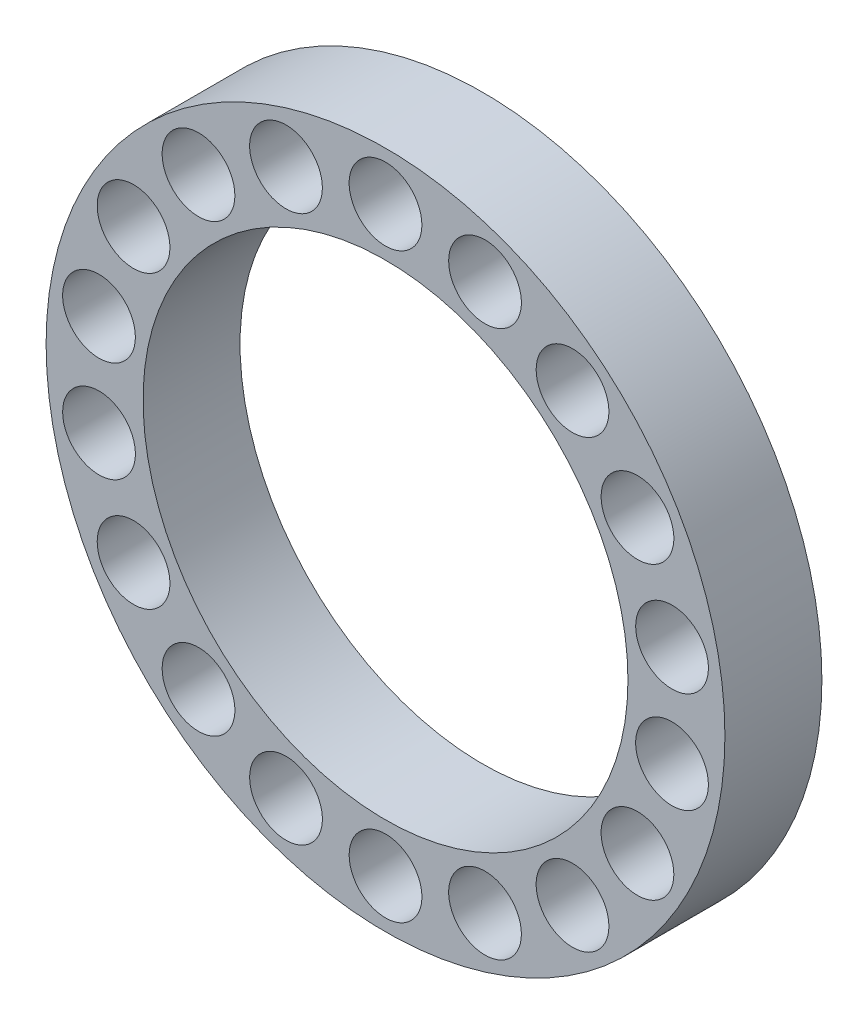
SolidWorks part; units mm, degrees
ref_plane "Front Plane" through (0, 0, 0) normal (0, 0, 1) x (1, 0, 0)
ref_plane "Top Plane" through (0, 0, 0) normal (0, 1, 0) x (1, 0, 0)
ref_plane "Right Plane" through (0, 0, 0) normal (1, 0, 0) x (0, 0, -1)
sketch "Sketch1" plane through (0, 0, 0) normal (0, 0, 1) x (1, 0, 0)
  circle A0 centre (0, 0) radius 6.35
  circle A1 centre (0, 0) radius 8.89
extrude "Boss-Extrude1" add sketch "Sketch1" along normal blind 2.54
sketch "Sketch2" plane through (0, 0, 0) normal (0, 0, 1) x (1, 0, 0)
  circle A0 centre (-4.898, 5.8373) radius 0.9525
  circle A1 centre (-6.5991, 3.81) radius 0.9525
  circle A2 centre (-7.5042, 1.3232) radius 0.9525
  circle A4 centre (0, 7.62) radius 0.9525
  circle A5 centre (-2.6062, 7.1605) radius 0.9525
  circle A6 centre (-2.6062, -7.1605) radius 0.9525
  circle A7 centre (0, -7.62) radius 0.9525
  circle A8 centre (-7.5042, -1.3232) radius 0.9525
  circle A9 centre (-6.5991, -3.81) radius 0.9525
  circle A10 centre (-4.898, -5.8373) radius 0.9525
  circle A11 centre (4.898, -5.8373) radius 0.9525
  circle A12 centre (6.5991, -3.81) radius 0.9525
  circle A13 centre (7.5042, -1.3232) radius 0.9525
  circle A14 centre (2.6062, -7.1605) radius 0.9525
  circle A15 centre (2.6062, 7.1605) radius 0.9525
  circle A16 centre (7.5042, 1.3232) radius 0.9525
  circle A17 centre (6.5991, 3.81) radius 0.9525
  circle A18 centre (4.898, 5.8373) radius 0.9525
extrude "Cut-Extrude2" cut sketch "Sketch2" along normal blind 2.54
sketch "Sketch4" [suppressed] plane through (0, 0, 2.54) normal (0, 0, 1) x (1, 0, 0)
  line L0 (0, 0) -> (-8.6873, 23.8682) construction
  line L1 (0, 0) -> (-16.3268, 19.4575) construction
  line L2 (0, 0) -> (-21.997, 12.7) construction
  line L3 (0, 0) -> (-25.0141, 4.4107) construction
  line L4 (0, 0) -> (-25.0141, -4.4107) construction
  line L5 (0, 0) -> (-21.997, -12.7) construction
  line L6 (0, 0) -> (-8.6873, -23.8682) construction
  line L7 (0, 0) -> (0, 25.4) construction
  line L8 (0, 0) -> (0, -25.4) construction
  line L9 (0, 0) -> (-16.3268, -19.4575) construction
  line L10 (0, 0) -> (16.3268, -19.4575) construction
  line L11 (0, 0) -> (8.6873, -23.8682) construction
  line L12 (0, 0) -> (21.997, -12.7) construction
  line L13 (0, 0) -> (25.0141, -4.4107) construction
  line L14 (0, 0) -> (25.0141, 4.4107) construction
  line L15 (0, 0) -> (21.997, 12.7) construction
  line L16 (0, 0) -> (16.3268, 19.4575) construction
  line L17 (0, 0) -> (8.6873, 23.8682) construction
